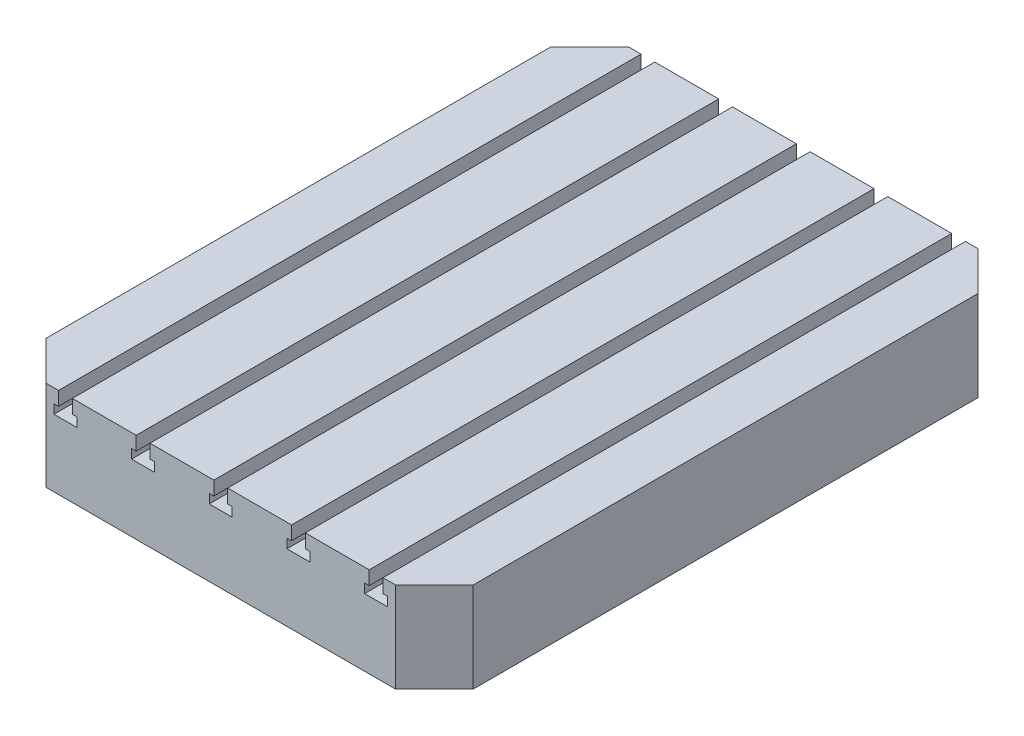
SolidWorks part; units mm, degrees
ref_plane "Front" through (0, 0, 0) normal (0, 0, 1) x (1, 0, 0)
ref_plane "Top" through (0, 0, 0) normal (0, 1, 0) x (1, 0, 0)
ref_plane "Right" through (0, 0, 0) normal (1, 0, 0) x (0, 0, -1)
sketch "Sketch1" plane through (0, 0, 0) normal (0, 1, 0) x (1, 0, 0)
  line L0 (0, 381) -> (0, -381) construction
  line L1 (-279.4, -381) -> (279.4, -381)
  line L2 (-279.4, -381) -> (-279.4, 381)
  line L3 (-279.4, 381) -> (279.4, 381)
  line L4 (279.4, -381) -> (279.4, 381)
  line L5 (-279.4, 0) -> (279.4, 0) construction
  point P8 (0, 0)
  dimension "D1" = 558.8
  dimension "D2" = 762
extrude "Base-Extrude" add sketch "Sketch1" against normal blind 118
sketch "Sketch2" plane through (0, 0, 381) normal (0, 0, 1) x (1, 0, 0)
  line L0 (-203.2, 0) -> (-203.2, -45.4957) construction
  line L1 (-279.4, 0) -> (279.4, 0) construction
  line L2 (-212.2, 0) -> (-194.2, 0)
  line L3 (0, 0) -> (0, -114.3727) construction
  line L4 (-212.2, 0) -> (-212.2, -18)
  line L5 (-212.2, -18) -> (-218.2, -18)
  line L6 (-218.2, -18) -> (-218.2, -30)
  line L7 (-218.2, -30) -> (-188.2, -30)
  line L8 (-188.2, -18) -> (-188.2, -30)
  line L9 (-194.2, -18) -> (-188.2, -18)
  line L10 (-194.2, 0) -> (-194.2, -18)
  line L11 (-110.6, 0) -> (-92.6, 0)
  line L12 (-110.6, 0) -> (-110.6, -18)
  line L13 (-110.6, -18) -> (-116.6, -18)
  line L14 (-116.6, -18) -> (-116.6, -30)
  line L15 (-116.6, -30) -> (-86.6, -30)
  line L16 (-86.6, -18) -> (-86.6, -30)
  line L17 (-92.6, -18) -> (-86.6, -18)
  line L18 (-92.6, 0) -> (-92.6, -18)
  line L19 (-101.6, 0) -> (-101.6, -45.4957) construction
  line L20 (-9, 0) -> (9, 0)
  line L21 (-9, 0) -> (-9, -18)
  line L22 (-9, -18) -> (-15, -18)
  line L23 (-15, -18) -> (-15, -30)
  line L24 (-15, -30) -> (15, -30)
  line L25 (15, -18) -> (15, -30)
  line L26 (9, -18) -> (15, -18)
  line L27 (9, 0) -> (9, -18)
  line L28 (0, 0) -> (0, -45.4957) construction
  line L29 (92.6, 0) -> (110.6, 0)
  line L30 (92.6, 0) -> (92.6, -18)
  line L31 (92.6, -18) -> (86.6, -18)
  line L32 (86.6, -18) -> (86.6, -30)
  line L33 (86.6, -30) -> (116.6, -30)
  line L34 (116.6, -18) -> (116.6, -30)
  line L35 (110.6, -18) -> (116.6, -18)
  line L36 (110.6, 0) -> (110.6, -18)
  line L37 (101.6, 0) -> (101.6, -45.4957) construction
  line L38 (194.2, 0) -> (212.2, 0)
  line L39 (194.2, 0) -> (194.2, -18)
  line L40 (194.2, -18) -> (188.2, -18)
  line L41 (188.2, -18) -> (188.2, -30)
  line L42 (188.2, -30) -> (218.2, -30)
  line L43 (218.2, -18) -> (218.2, -30)
  line L44 (212.2, -18) -> (218.2, -18)
  line L45 (212.2, 0) -> (212.2, -18)
  line L46 (203.2, 0) -> (203.2, -45.4957) construction
  point P13 (-203.2, -30)
  point P26 (-101.6, -30)
  point P37 (0, -30)
  point P48 (101.6, -30)
  point P59 (203.2, -30)
  dimension "D1" = 203.2
  dimension "D2" = 18
  dimension "D3" = 30
  dimension "D4" = 30
  dimension "D5" = 12
  dimension "D6" = 5
extrude "Cut-Extrude1" cut sketch "Sketch2" against normal through all
chamfer "Chamfer1" distance 50.8 angle 45 4 edges at (-279.4, -59, -381) (279.4, -59, -381) (279.4, -59, 381) (-279.4, -59, 381)
